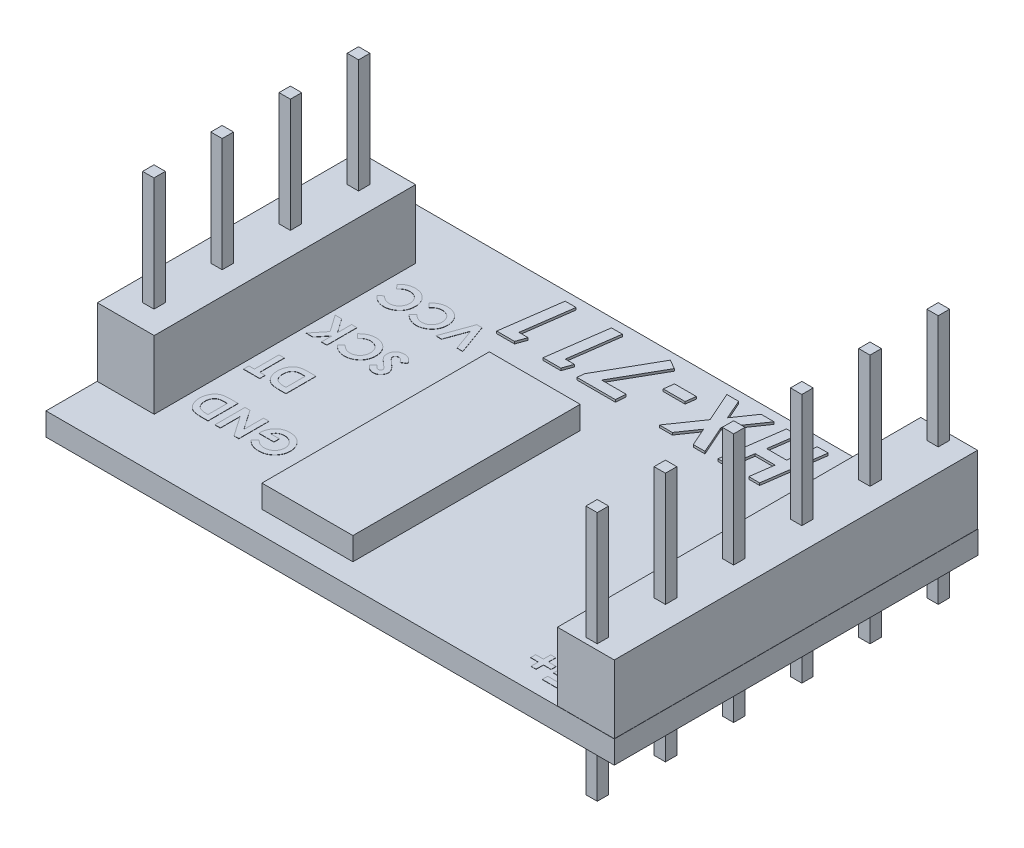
SolidWorks part; units mm, degrees
ref_plane "Front" through (0, 0, 0) normal (0, 0, 1) x (1, 0, 0)
ref_plane "Top" through (0, 0, 0) normal (0, 1, 0) x (1, 0, 0)
ref_plane "Right" through (0, 0, 0) normal (1, 0, 0) x (0, 0, -1)
sketch "Sketch1" plane through (0, 0, 0) normal (0, 1, 0) x (1, 0, 0)
  line L1 (25, -16) -> (0, -16)
  line L2 (25, -16) -> (25, 0)
  line L3 (25, 0) -> (0, 0)
  line L4 (0, -16) -> (0, 0)
  dimension "D1" = 16
  dimension "D2" = 25
extrude "Boss-Extrude1" add sketch "Sketch1" along normal blind 1
sketch "Sketch2" plane through (0, 1, 0) normal (0, 1, 0) x (1, 0, 0)
  line L0 (25, -16) -> (25, 0) construction
  line L1 (0, -16) -> (25, -16) construction
  line L2 (0, 0) -> (0, -16) construction
  point P0 (1.25, -3.5)
  point P1 (1.25, -6.5)
  point P2 (1.25, -9.5)
  point P3 (1.25, -12.5)
  point P4 (23.75, -0.5)
  point P5 (23.75, -3.5)
  point P6 (23.75, -6.5)
  point P7 (23.75, -9.5)
  point P8 (23.75, -12.5)
  point P9 (23.75, -15.5)
  point P10 (23.6922, -2.9792)
  point P11 (23.6922, -1.5671)
  point P12 (23.6974, -11.8702)
  point P13 (23.7159, -14.9036)
  point P14 (23.4975, -14.7728)
  point P15 (0, 0)
  point P16 (0, 0)
  point P21 (0, 0)
  point P22 (0, 0)
  point P23 (0, 0)
  point P24 (0, 0)
  point P25 (0, 0)
hole_wizard "Ø4.0mm Dowel Hole1" positions "3DSketch1" profile "Sketch3" hole size "Ø4.0" standard "ISO"
sketch3d "3DSketch1"
  point P0 (1.25, 1, 3.5)
  point P3 (1.25, 1, 6.5)
  point P6 (1.25, 1, 9.5)
  point P9 (1.25, 1, 12.5)
  point P12 (23.75, 1, 15.5)
  point P15 (23.75, 1, 12.5)
  point P18 (23.75, 1, 9.5)
  point P21 (23.75, 1, 6.5)
  point P24 (23.75, 1, 3.5)
  point P27 (23.75, 1, 0.5)
sketch "Sketch3" plane through (1.25, 1, 3.5) normal (1, 0, 0) x (0, 0, 1)
  line L0 (0, 0) -> (0, 15.1502)
  line L1 (0, 15.1502) -> (0.25, 15)
  line L2 (0.25, 15) -> (0.25, 0)
  line L5 (0.25, 0) -> (0, 0)
  line L10 (0, 15.1502) -> (-0.25, 15) construction
  line L11 (0, -6.35) -> (0, 107.95) construction
  dimension "Hole Dia." = 0.5
  dimension "Hole Depth" = 15
  dimension "Drill Angle" = 118
sketch "Sketch4" plane through (0, 1, 0) normal (0, 1, 0) x (1, 0, 0)
  line L0 (0, -0.5) -> (25, -0.5) construction
  line L1 (25, -16) -> (25, 0) construction
  line L2 (0, 0) -> (0, -16) construction
  line L4 (25, 0) -> (0, 0) construction
  text T0 "<b><i>HX-711</i></b>" font "Century Gothic" height in points 10
  point P2 (20.7421, -14.197)
  point P4 (4.7146, -14.313)
  point P5 (25, -14.3729)
  point P8 (0, -14.1746)
  dimension "D1" = 0.5
extrude "Boss-Extrude2" add sketch "Sketch4" along normal blind 0.1
sketch "Sketch5" plane through (0, 1, 0) normal (0, 1, 0) x (1, 0, 0)
  line L0 (25, 0) -> (0, 0) construction
  line L1 (8.5, -5) -> (12.5, -5)
  line L2 (8.5, -5) -> (8.5, -15)
  line L3 (8.5, -15) -> (12.5, -15)
  line L4 (12.5, -5) -> (12.5, -15)
  line L5 (25, -16) -> (25, 0) construction
  dimension "D1" = 4
  dimension "D2" = 10
  dimension "D3" = 5
  dimension "D4" = 12.5
extrude "Boss-Extrude3" add sketch "Sketch5" along normal blind 1
sketch "Sketch6" plane through (0, 1, 0) normal (0, 1, 0) x (1, 0, 0)
  line L0 (1, -6.25) -> (1, -6.75)
  line L1 (1, -3.25) -> (1.5, -3.25)
  line L2 (1, -3.25) -> (1, -3.75)
  line L3 (1, -3.75) -> (1.5, -3.75)
  line L4 (1.5, -3.25) -> (1.5, -3.75)
  line L5 (1, -6.75) -> (1.5, -6.75)
  line L6 (1.5, -6.25) -> (1.5, -6.75)
  line L7 (1, -6.25) -> (1.5, -6.25)
  line L8 (1, -9.25) -> (1, -9.75)
  line L9 (1, -9.75) -> (1.5, -9.75)
  line L10 (1.5, -9.25) -> (1.5, -9.75)
  line L11 (1, -9.25) -> (1.5, -9.25)
  line L12 (1, -12.25) -> (1, -12.75)
  line L13 (1, -12.75) -> (1.5, -12.75)
  line L14 (1.5, -12.25) -> (1.5, -12.75)
  line L15 (1, -12.25) -> (1.5, -12.25)
  line L17 (23.5, -3.25) -> (23.5, -3.75)
  line L18 (23.5, -0.25) -> (24, -0.25)
  line L19 (23.5, -0.25) -> (23.5, -0.75)
  line L20 (23.5, -0.75) -> (24, -0.75)
  line L21 (24, -0.25) -> (24, -0.75)
  line L22 (23.5, -3.25) -> (24, -3.25)
  line L23 (24, -3.25) -> (24, -3.75)
  line L24 (23.5, -3.75) -> (24, -3.75)
  line L25 (23.5, -6.25) -> (23.5, -6.75)
  line L26 (23.5, -6.25) -> (24, -6.25)
  line L27 (24, -6.25) -> (24, -6.75)
  line L28 (23.5, -6.75) -> (24, -6.75)
  line L29 (23.5, -9.25) -> (23.5, -9.75)
  line L30 (23.5, -9.25) -> (24, -9.25)
  line L31 (24, -9.25) -> (24, -9.75)
  line L32 (23.5, -9.75) -> (24, -9.75)
  line L33 (23.5, -12.25) -> (23.5, -12.75)
  line L34 (23.5, -12.25) -> (24, -12.25)
  line L35 (24, -12.25) -> (24, -12.75)
  line L36 (23.5, -12.75) -> (24, -12.75)
  line L37 (23.5, -15.25) -> (23.5, -15.75)
  line L38 (23.5, -15.25) -> (24, -15.25)
  line L39 (24, -15.25) -> (24, -15.75)
  line L40 (23.5, -15.75) -> (24, -15.75)
  circle A0 centre (1.25, -3.5) radius 0.25 construction
  circle A2 centre (23.75, -0.5) radius 0.25 construction
  dimension "D1" = 0.5
  dimension "D2" = 0.5
  dimension "D3" = 0.25
  dimension "D4" = 0.25
  dimension "D6" = 0.5
  dimension "D7" = 0.5
  dimension "D8" = 0.25
  dimension "D9" = 0.25
  dimension "D5" = 4
  dimension "D10" = 6
extrude "Boss-Extrude4" add sketch "Sketch6" against normal blind 3 and the other way blind 8 contours L19 L18 L21 L20 | L17 L24 L23 L22 | L25 L28 L27 L26 | L29 L32 L31 L30 | L33 L36 L35 L34 | L37 L40 L39 L38 | L12 L13 L14 L15 | L8 L9 L10 L11 | L0 L5 L6 L7 | L2 L1 L4 L3
sketch "Sketch7" plane through (0, 1, 0) normal (0, 1, 0) x (1, 0, 0)
  line L1 (24.99, -0.01) -> (22.49, -0.01)
  line L2 (24.99, -0.01) -> (24.99, -15.99)
  line L3 (24.99, -15.99) -> (22.49, -15.99)
  line L4 (22.49, -0.01) -> (22.49, -15.99)
  line L6 (0.01, -2.25) -> (2.51, -2.25)
  line L7 (0.01, -2.25) -> (0.01, -13.75)
  line L8 (0.01, -13.75) -> (2.51, -13.75)
  line L9 (2.51, -2.25) -> (2.51, -13.75)
  line L10 (1, -3.25) -> (1.5, -3.25) construction
  line L11 (1.5, -12.75) -> (1, -12.75) construction
  line L13 (25, 0) -> (0, 0) construction
  line L14 (0, -16) -> (25, -16) construction
  line L15 (0, 0) -> (0, -16) construction
  line L16 (25, -16) -> (25, 0) construction
  point P5 (22.5, -15.3851)
  point P17 (25, -0.7278)
  point P22 (0, 0)
  point P23 (0, 0)
  point P25 (0, 0)
  point P26 (0, 0)
  dimension "D1" = 2.5
  dimension "D2" = 1
  dimension "D3" = 1
  dimension "D4" = 2.5
  dimension "D5" = 0.01
  dimension "D6" = 0.01
  dimension "D7" = 0.01
  dimension "D8" = 0.01
extrude "Boss-Extrude5" add sketch "Sketch7" along normal blind 3
sketch "Sketch8" plane through (0, 1, 0) normal (0, 1, 0) x (1, 0, 0)
  line L0 (22.0186, -14) -> (20.4496, -14) construction
  line L1 (0, -16) -> (25, -16) construction
  line L2 (22.0186, -11.25) -> (20.4496, -11.25) construction
  line L3 (22.0186, -8.5) -> (20.4496, -8.5) construction
  line L4 (22.0186, -5.75) -> (20.4496, -5.75) construction
  line L5 (22.0186, -3) -> (20.4496, -3) construction
  line L6 (22.0186, -0.25) -> (20.4496, -0.25) construction
  line L7 (7.6884, -11.5) -> (2.7461, -11.5) construction
  line L8 (7.6884, -8.75) -> (2.7461, -8.75) construction
  line L9 (7.6884, -6) -> (2.7461, -6) construction
  line L10 (7.6884, -3.25) -> (2.7461, -3.25) construction
  text T0 "<b>E+</b>" font "Century Gothic" height in points 5
  text T1 "<b>E-</b>" font "Century Gothic" height in points 5
  text T2 "A-" font "Century Gothic" height in points 5
  text T3 "<b>A+</b>" font "Century Gothic" height in points 5
  text T4 "<b>B-</b>" font "Century Gothic" height in points 5
  text T5 "<b>B+</b>" font "Century Gothic" height in points 5
  text T6 "<b>GND</b>" font "Century Gothic" height in points 5
  text T7 "<b>DT</b>" font "Century Gothic" height in points 5
  text T8 "<b>SCK</b>" font "Century Gothic" height in points 5
  text T9 "<b>VCC</b>" font "Century Gothic" height in points 5
  point P17 (6.6163, -11.4)
  point P18 (0, 0)
  point P21 (0, 0)
  point P28 (7.1916, -11.4)
  point P29 (0, 0)
  point P30 (6.8778, -11.5)
  point P34 (7.6884, -11.5)
  dimension "D1" = 2
  dimension "D3" = 4
  dimension "D4" = 4.5
  dimension "D2" = 6
extrude "Boss-Extrude6" add sketch "Sketch8" along normal blind 0.01
equation "\"D2@Sketch2\"=\"D1@Sketch2\""
equation "\"D3@Sketch2\"=\"D1@Sketch2\""
equation "\"D4@Sketch2\"=\"D1@Sketch2\""
equation "\"D5@Sketch2\"=\"D1@Sketch2\""
